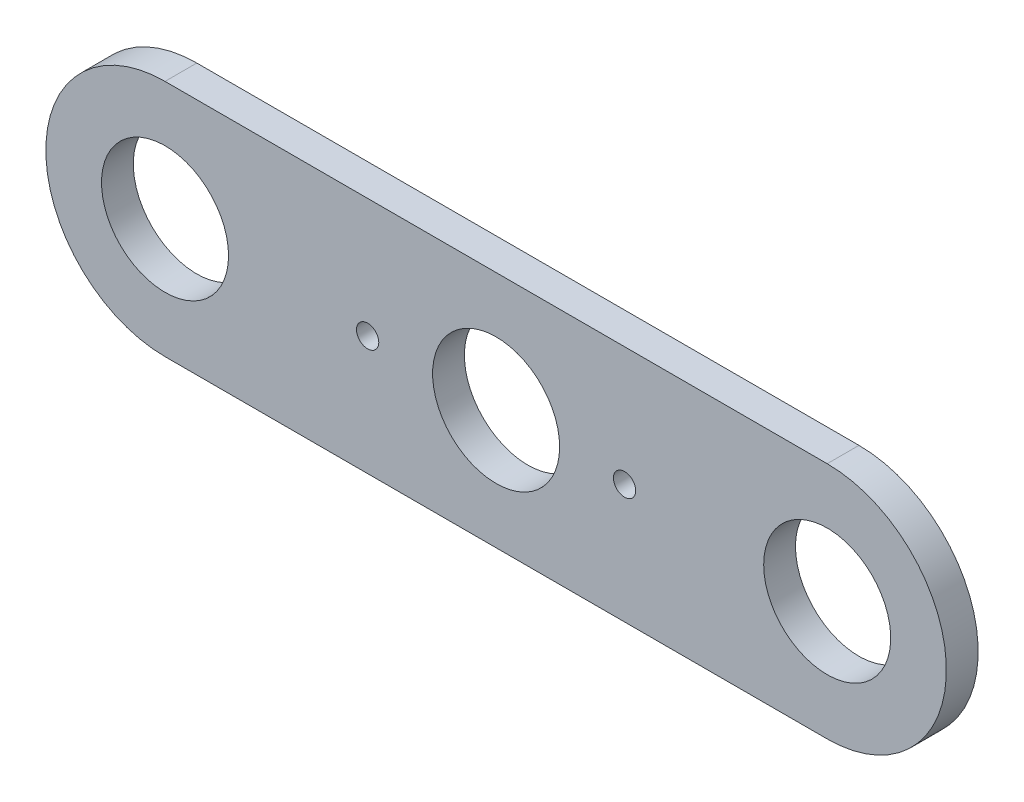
SolidWorks part; units mm, degrees
ref_plane "Front Plane" through (0, 0, 0) normal (0, 0, 1) x (1, 0, 0)
ref_plane "Top Plane" through (0, 0, 0) normal (0, 1, 0) x (1, 0, 0)
ref_plane "Right Plane" through (0, 0, 0) normal (1, 0, 0) x (0, 0, -1)
sketch "Sketch2" plane through (0, 0, 0) normal (0, 0, 1) x (1, 0, 0)
  line L0 (0, 22.5) -> (0, -22.5) construction
  line L1 (-62.5, -22.5) -> (62.5, -22.5)
  line L3 (-62.5, 22.5) -> (62.5, 22.5)
  line L5 (-62.5, -22.5) -> (62.5, 22.5) construction
  line L6 (-62.5, 22.5) -> (62.5, -22.5) construction
  arc A0 (62.5, -22.5) -> (62.5, 22.5) centre (62.5, 0) ccw
  arc A1 (-62.5, -22.5) -> (-62.5, 22.5) centre (-62.5, 0) cw
  circle A2 centre (-62.5, 0) radius 11.99
  circle A4 centre (62.5, 0) radius 11.99
  circle A5 centre (0, 0) radius 11.99
  point P0 (0, 0)
  dimension "D3" = 23.98
  dimension "D4" = 23.98
  dimension "D1" = 45
  dimension "D2" = 125
extrude "Boss-Extrude1" add sketch "Sketch2" along normal blind 6
sketch "Sketch3" plane through (0, 0, 6) normal (0, 0, 1) x (1, 0, 0)
  line L0 (-62.5, 0) -> (0, 0) construction
  line L1 (0, -1000) -> (0, 49000) construction
  circle A0 centre (-24.25, 0) radius 2.1
  circle A1 centre (24.25, 0) radius 2.1
  point P10 (0, 0)
  dimension "D1" = 4.2
  dimension "D2" = 24.25
extrude "Cut-Extrude1" cut sketch "Sketch3" against normal blind 10
